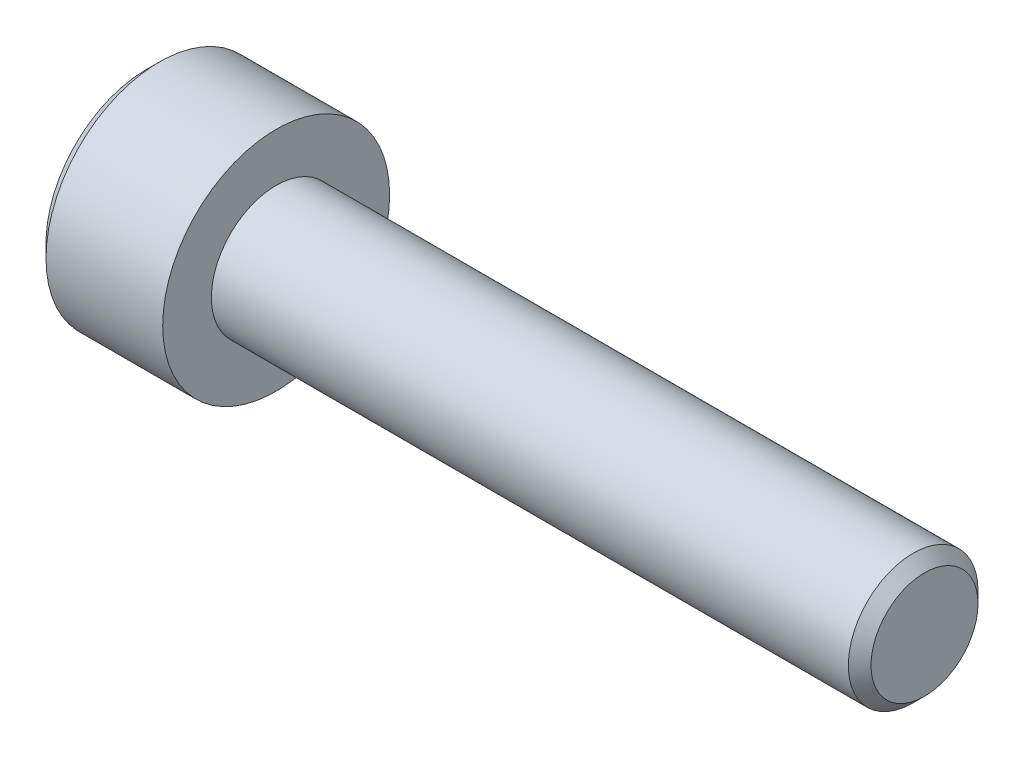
SolidWorks part; units mm, degrees
ref_plane "Front Plane" through (0, 0, 0) normal (0, 0, 1) x (1, 0, 0)
ref_plane "Top Plane" through (0, 0, 0) normal (0, 1, 0) x (1, 0, 0)
ref_plane "Right Plane" through (0, 0, 0) normal (1, 0, 0) x (0, 0, -1)
sketch "Sketch1" plane through (0, 0, 0) normal (1, 0, 0) x (0, 0, -1)
  circle A0 centre (0, 0) radius 3.5
  dimension "D1" = 7
extrude "Boss-Extrude1" add sketch "Sketch1" along normal blind 4
sketch "Sketch2" plane through (0, 0, 0) normal (-1, 0, 0) x (0, 0, 1)
  line L1 (-1.7321, 0) -> (-0.866, -1.5)
  line L2 (-0.866, -1.5) -> (0.866, -1.5)
  line L3 (0.866, -1.5) -> (1.7321, 0)
  line L4 (1.7321, 0) -> (0.866, 1.5)
  line L5 (0.866, 1.5) -> (-0.866, 1.5)
  line L6 (-0.866, 1.5) -> (-1.7321, 0)
  circle A0 centre (0, 0) radius 1.5 construction
  dimension "D1" = 3
extrude "Cut-Extrude1" cut sketch "Sketch2" against normal blind 2.2
chamfer "Chamfer1" distance 0.4 angle 45 1 edges at (0, 0, -3.5)
sketch "Sketch4" plane through (4, 0, 0) normal (1, 0, 0) x (0, 0, -1)
  circle A0 centre (0, 0) radius 2
  dimension "D1" = 4
extrude "Boss-Extrude2" add sketch "Sketch4" along normal blind 20
chamfer "Chamfer2" distance 0.35 angle 45 1 edges at (24, 0, -2)
